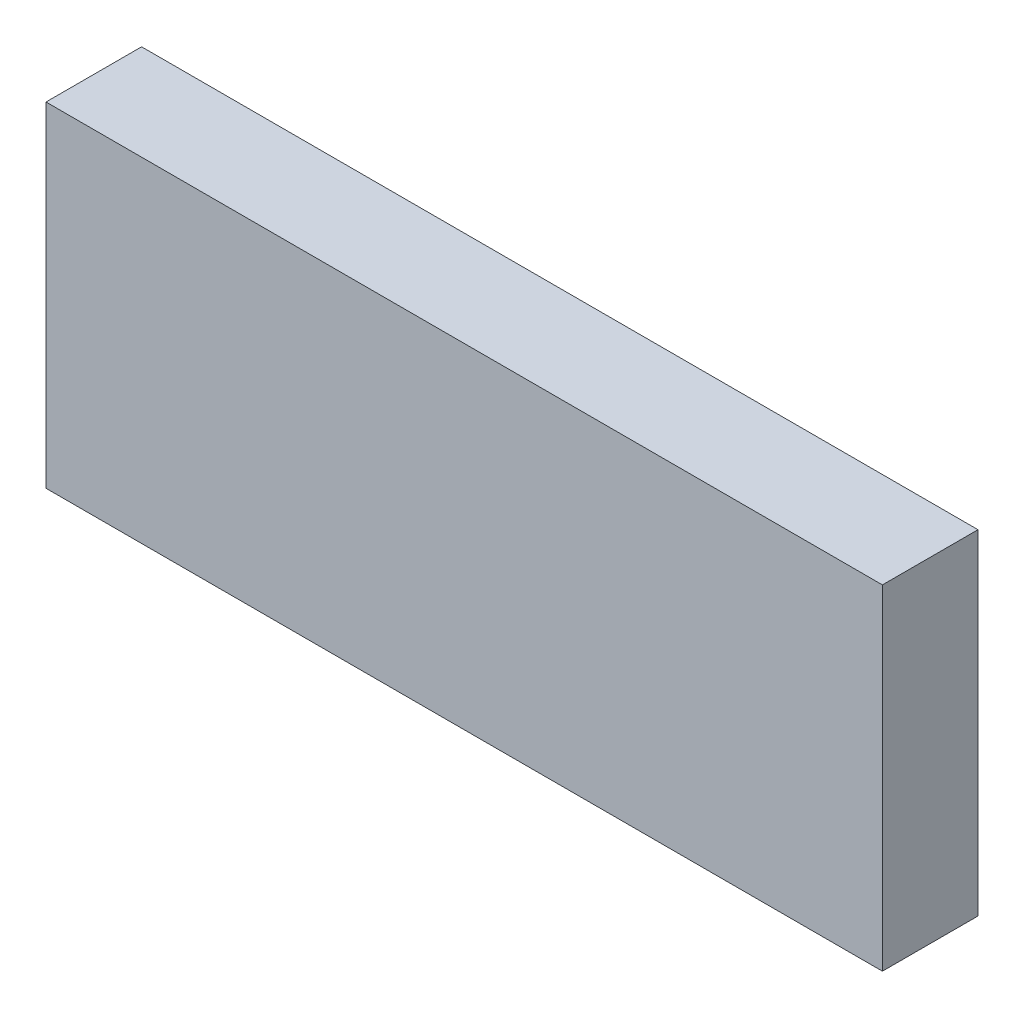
SolidWorks part; units mm, degrees
ref_plane "前视基准面" through (0, 0, 0) normal (0, 0, 1) x (1, 0, 0)
ref_plane "上视基准面" through (0, 0, 0) normal (0, 1, 0) x (1, 0, 0)
ref_plane "右视基准面" through (0, 0, 0) normal (1, 0, 0) x (0, 0, -1)
other "Configuration Table"
sketch "草图1" plane through (0, 0, 0) normal (0, 0, 1) x (1, 0, 0)
  line L1 (0, 0) -> (35, 0)
  line L2 (0, 0) -> (0, 14)
  line L3 (0, 14) -> (35, 14)
  line L4 (35, 0) -> (35, 14)
extrude "V2_REF_gripper_finger" add sketch "草图1" along normal blind 4
